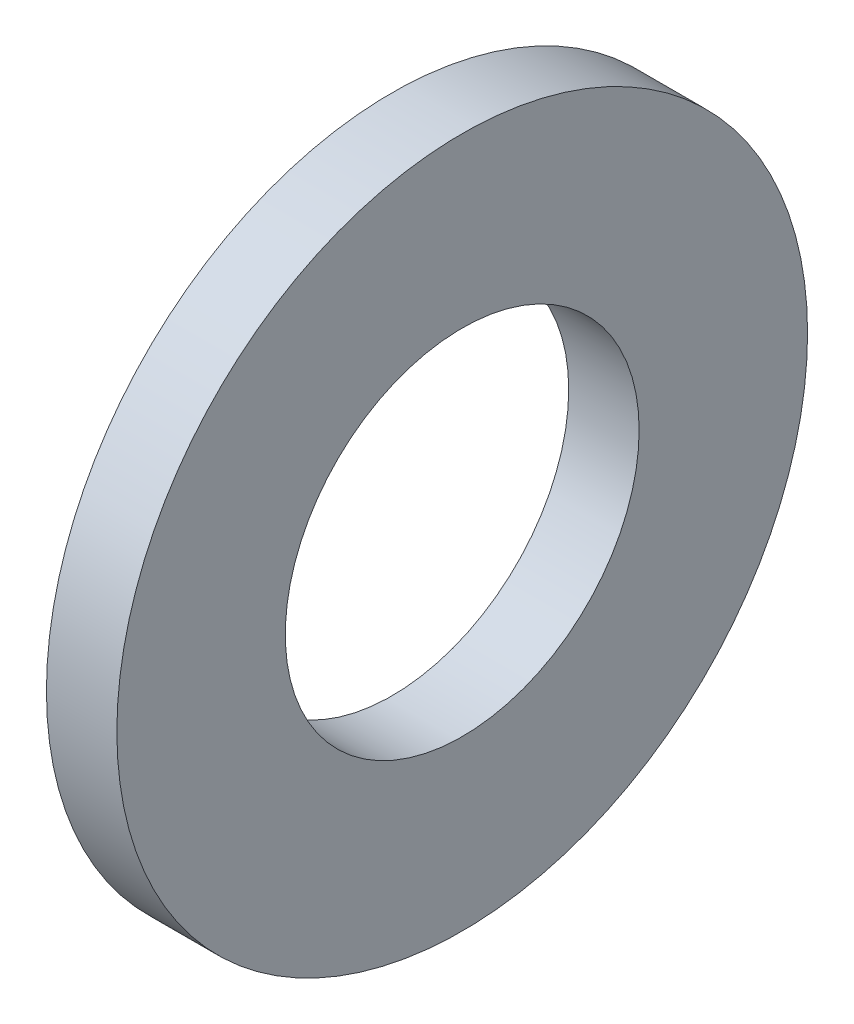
SolidWorks part; units mm, degrees
ref_plane "Plane1" through (0, 0, 0) normal (0, 0, 1) x (1, 0, 0)
ref_plane "Plane2" through (0, 0, 0) normal (0, 1, 0) x (1, 0, 0)
ref_plane "Plane3" through (0, 0, 0) normal (1, 0, 0) x (0, 0, -1)
other "Configuration Table"
sketch "Sketch1" plane through (0, 0, 0) normal (1, 0, 0) x (0, 0, -1)
  circle A0 centre (0, 0) radius 3.015
  circle A1 centre (0, 0) radius 5.885
  dimension "OutsideDia" = 11.77
  dimension "InsideDia" = 6.03
extrude "Base-Extrude" add sketch "Sketch1" along normal blind 1.2
